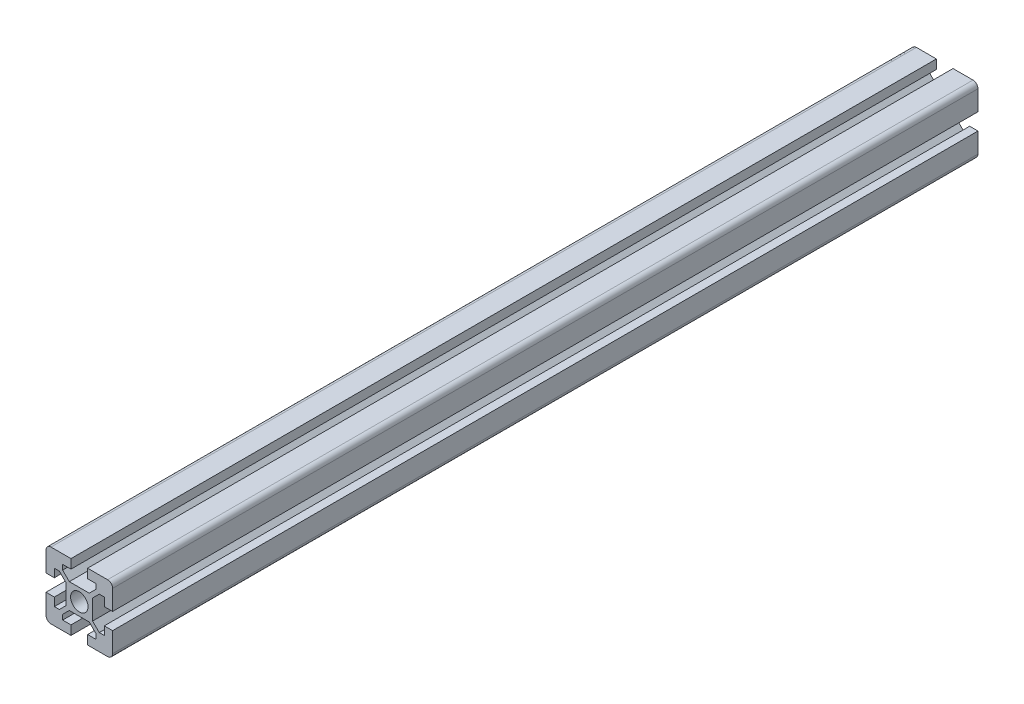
SolidWorks part; units mm, degrees
ref_plane "前基準面" through (0, 0, 0) normal (0, 0, 1) x (1, 0, 0)
ref_plane "上基準面" through (0, 0, 0) normal (0, 1, 0) x (1, 0, 0)
ref_plane "右基準面" through (0, 0, 0) normal (1, 0, 0) x (0, 0, -1)
sketch "草圖1" plane through (0, 0, 0) normal (0, 0, 1) x (1, 0, 0)
  line L0 (15, -5.5) -> (10, -5.5)
  line L1 (3, 0) -> (15, 0)
  line L2 (0, -3) -> (0, -15)
  line L3 (3, -40) -> (15, -40)
  line L4 (40, -3) -> (40, -15)
  line L5 (24.67, -40) -> (37, -40)
  line L6 (15, 0) -> (15, -5.5)
  line L7 (25, 0) -> (37, 0)
  line L8 (25, 0) -> (25, -5.5)
  line L9 (10, -5.5) -> (10, -8.5)
  line L10 (10, -8.5) -> (14, -12.5)
  line L11 (14, -12.5) -> (26, -12.5)
  line L12 (26, -12.5) -> (30, -8.5)
  line L13 (30, -8.5) -> (30, -5.5)
  line L14 (30, -5.5) -> (25, -5.5)
  line L17 (0, -25) -> (0, -37)
  line L18 (30, -34.5) -> (25, -34.5)
  line L19 (30, -31.5) -> (30, -34.5)
  line L20 (26, -27.5) -> (30, -31.5)
  line L21 (14, -27.5) -> (26, -27.5)
  line L22 (10, -31.5) -> (14, -27.5)
  line L23 (10, -34.5) -> (10, -31.5)
  line L24 (25, -40) -> (25, -34.5)
  line L25 (5, -15) -> (5, -10)
  line L26 (0, -15) -> (5, -15)
  line L27 (15, -40) -> (15, -34.5)
  line L28 (0, -25) -> (5, -25)
  line L29 (15, -34.5) -> (10, -34.5)
  line L30 (5, -10) -> (8, -10)
  line L31 (8, -10) -> (12, -14)
  line L32 (12, -14) -> (12, -26)
  line L33 (12, -26) -> (8, -30)
  line L34 (8, -30) -> (5, -30)
  line L35 (5, -30) -> (5, -25)
  line L36 (35, -30) -> (35, -25)
  line L37 (32, -30) -> (35, -30)
  line L38 (28, -26) -> (32, -30)
  line L39 (28, -14) -> (28, -26)
  line L40 (32, -10) -> (28, -14)
  line L41 (35, -10) -> (32, -10)
  line L42 (40, -25) -> (35, -25)
  line L43 (40, -15) -> (35, -15)
  line L44 (35, -15) -> (35, -10)
  line L45 (40, -25) -> (40, -37)
  circle A0 centre (20, -20) radius 5.25
  arc A1 (37, -40) -> (40, -37) centre (37, -37) ccw
  arc A2 (0, -37) -> (3, -40) centre (3, -37) ccw
  arc A3 (37, 0) -> (40, -3) centre (37, -3) cw
  arc A4 (3, 0) -> (0, -3) centre (3, -3) ccw
  point P52 (0, -40)
  point P55 (40, 0)
  point P58 (0, 0)
  dimension "D23" = 10.5
  dimension "D26" = 3
  dimension "D1" = 40
  dimension "D2" = 40
  dimension "D3" = 10
  dimension "D4" = 20
  dimension "D5" = 5
  dimension "D6" = 7
  dimension "D7" = 7
  dimension "D8" = 5.5
  dimension "D9" = 12
  dimension "D10" = 4
  dimension "D11" = 4
  dimension "D12" = 20
  dimension "D13" = 10
  dimension "D14" = 5
  dimension "D15" = 5
  dimension "D16" = 7
  dimension "D17" = 12
  dimension "D18" = 4
  dimension "D19" = 3
  dimension "D20" = 3
  dimension "D21" = 15
  dimension "D22" = 15
  dimension "D24" = 20
  dimension "D25" = 20
extrude "填料-伸長1" add sketch "草圖1" along normal blind 520 contours L1 A4 L2 L26 L25 L30 L31 L32 L33 L34 L35 L28 L17 A2 L3 L27 L29 L23 L22 L21 L20 L19 L18 L24 L5 A1 L45 L42 L36 L37 L38 L39 L40 L41 L44 L43 L4 A3 L7 L8 L14 L13 L12 L11 L10 L9 L0 L6 A0
